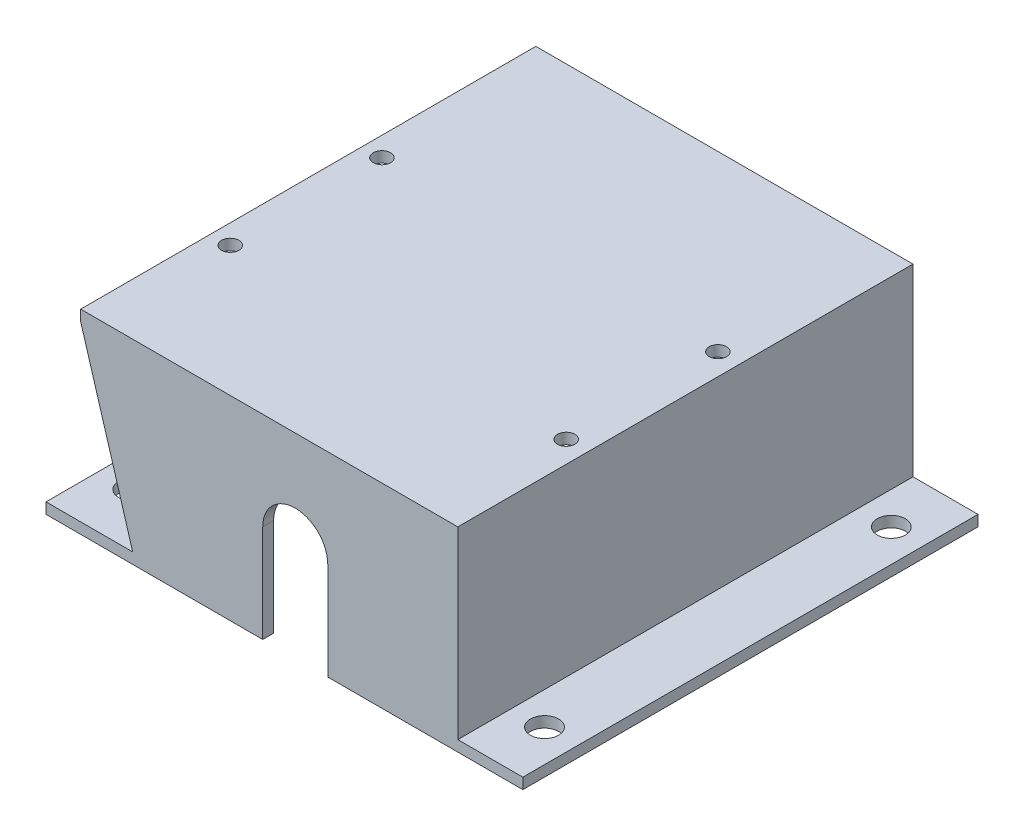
SolidWorks part; units mm, degrees
ref_plane "Plan1" through (0, 0, 0) normal (0, 0, 1) x (1, 0, 0)
ref_plane "Plan2" through (0, 0, 0) normal (0, 1, 0) x (1, 0, 0)
ref_plane "Plan3" through (0, 0, 0) normal (1, 0, 0) x (0, 0, -1)
sketch "Esquisse1" plane through (0, 0, 0) normal (0, 0, 1) x (1, 0, 0)
  line L0 (0, 0) -> (40, 0)
  line L1 (40, 0) -> (40, 80)
  line L2 (40, 80) -> (16, 80)
  line L3 (16, 80) -> (16, 85)
  line L4 (16, 85) -> (190, 85)
  line L5 (190, 85) -> (190, 0)
  line L6 (190, 0) -> (220, 0)
  line L7 (220, 0) -> (220, -5)
  line L8 (220, -5) -> (185, -5)
  line L9 (0, -5) -> (0, 0)
  line L10 (45, -5) -> (0, -5)
  line L11 (45, 80) -> (185, 80)
  line L12 (45, 80) -> (45, -5)
  line L14 (185, 80) -> (185, -5)
  dimension "D1" = 220
  dimension "D2" = 40
  dimension "D3" = 5
  dimension "D4" = 5
  dimension "D5" = 5
  dimension "D6" = 5
  dimension "D7" = 30
  dimension "D8" = 90
  dimension "D9" = 174
extrude "Extrusion1" add sketch "Esquisse1" along normal blind 210
sketch "Esquisse2" plane through (0, 0, 210) normal (0, 0, 1) x (1, 0, 0)
  line L0 (16, 80) -> (40, 0)
  line L1 (40, 0) -> (0, 0) construction
  line L2 (40, 0) -> (45, -5)
  line L3 (45, -5) -> (185, -5)
  line L4 (185, -5) -> (185, 80)
  line L5 (185, 80) -> (16, 80)
extrude "Extrusion2" add sketch "Esquisse2" against normal blind 5
sketch "Esquisse3" plane through (0, 0, 0) normal (0, 0, -1) x (-1, 0, 0)
  line L0 (-16, 80) -> (-40, 0)
  line L1 (-40, 0) -> (-45, -5)
  line L2 (-45, -5) -> (-185, -5)
  line L3 (-185, -5) -> (-185, 80)
  line L4 (-185, 80) -> (-16, 80)
extrude "Extrusion3" add sketch "Esquisse3" against normal blind 5
sketch "Esquisse4" plane through (0, 0, 210) normal (0, 0, 1) x (1, 0, 0)
  line L0 (0, -5) -> (220, -5) construction
  line L1 (100, 40) -> (100, -5)
  line L2 (100, -5) -> (130, -5)
  line L3 (130, 40) -> (130, -5)
  line L4 (190, 0) -> (190, 85) construction
  arc A0 (130, 40) -> (100, 40) centre (115, 40) ccw
  dimension "D1" = 45
  dimension "D2" = 30
  dimension "D3" = 75
extrude "Enlèv. mat.-Extru.1" cut sketch "Esquisse4" against normal blind 5
sketch "Esquisse5" plane through (0, -5, 0) normal (0, -1, 0) x (1, 0, 0)
  line L0 (130, 210) -> (220, 210) construction
  line L1 (220, 210) -> (220, 0) construction
  circle A0 centre (205, 185) radius 6.5
  dimension "D1" = 25
  dimension "D2" = 15
  dimension "D3" = 13
extrude "Enlèv. mat.-Extru.2" cut sketch "Esquisse5" against normal blind 5
pattern_linear "Répétition linéaire1" count 2 spacing 160 count 2 spacing 190
sketch "Esquisse6" plane through (0, 85, 0) normal (0, 1, 0) x (-1, 0, 0)
  line L0 (-180, 150) -> (-25, 150) construction
  line L1 (-180, 150) -> (-180, 80) construction
  line L2 (-190, 210) -> (-16, 210) construction
  point P0 (-180, 150)
  point P2 (-25, 150)
  point P4 (-180, 80)
  point P5 (-25, 80)
  dimension "D1" = 90
  dimension "D2" = 60
hole_wizard "Trou taraudé M8x1.252" positions "Esquisse3D2" profile "Esquisse8" tap size "M8x1.25" standard "ISO"
sketch3d "Esquisse3D2"
  point P0 (180, 85, 80)
  point P2 (180, 85, 150)
  point P4 (25, 85, 150)
  point P6 (25, 85, 80)
sketch "Esquisse8" plane through (180, 85, 80) normal (1, 0, 0) x (0, 0, 1)
  line L0 (0, 0) -> (0, 90)
  line L1 (0, 90) -> (3.4, 90)
  line L3 (3.4, 90) -> (3.4, 16)
  line L4 (3.4, 16) -> (4, 16)
  line L5 (4, 16) -> (4, 0)
  line L7 (4, 0) -> (0, 0)
  line L11 (0, -6.35) -> (0, 107.95) construction
  dimension "Diamètre du trou pour taraudage jusqu'au prochain" = 6.8
  dimension "Profondeur du trou pour taraudage jusqu'au prochain" = 90
  dimension "Diamètre principal du filetage" = 8
  dimension "Profondeur du filetage" = 16
